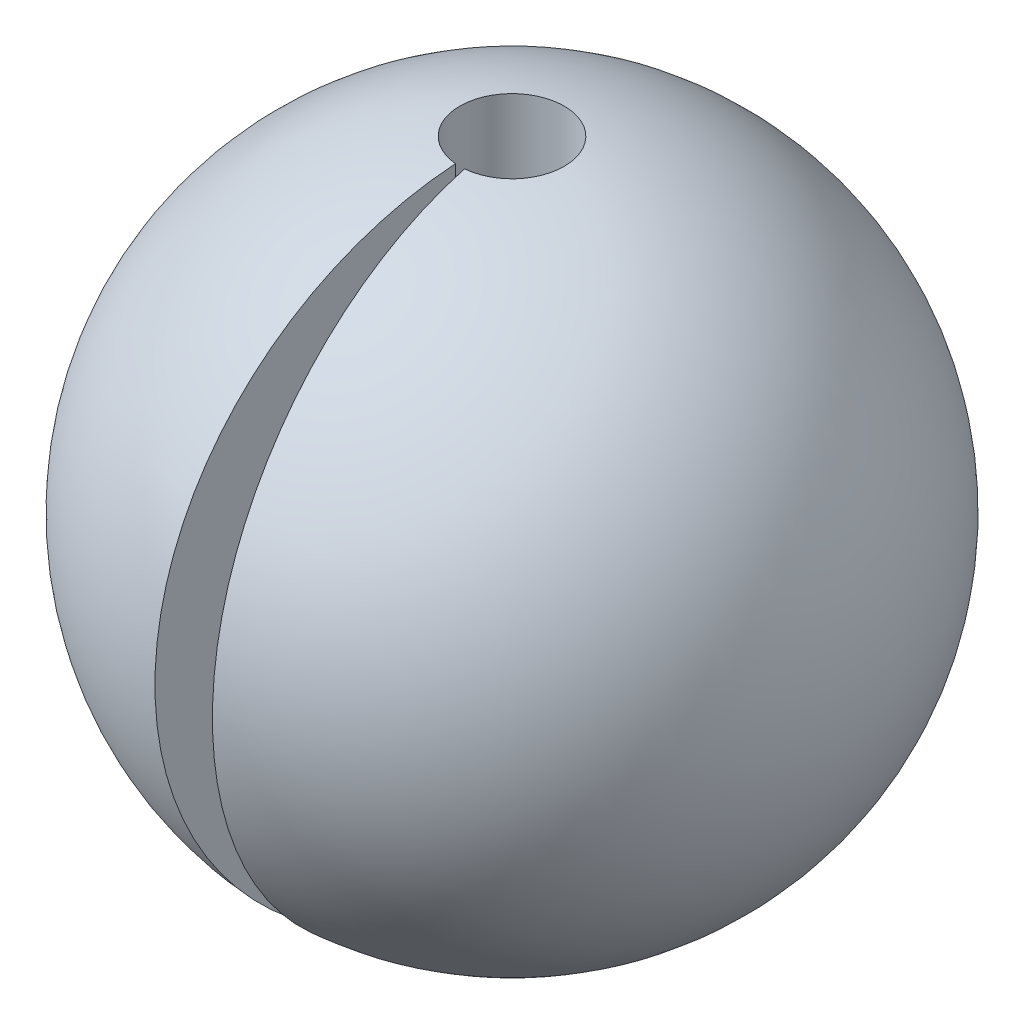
SolidWorks part; units mm, degrees
ref_plane "前视基准面" through (0, 0, 0) normal (0, 0, 1) x (1, 0, 0)
ref_plane "上视基准面" through (0, 0, 0) normal (0, 1, 0) x (1, 0, 0)
ref_plane "右视基准面" through (0, 0, 0) normal (1, 0, 0) x (0, 0, -1)
sketch "草图1" plane through (0, 0, 0) normal (0, 0, 1) x (1, 0, 0)
  line L0 (0, 0) -> (0, 1987.6788) construction
  line L1 (-301, 1876.0061) -> (-301, -1876.0061)
  arc A0 (-301, 1876.0061) -> (-301, -1876.0061) centre (0, 0) ccw
  dimension "D1" = 3800
  dimension "D2" = 301
revolve "旋转2" add sketch "草图1" angle 360 about L0
sketch "草图2" plane through (0, 0, 0) normal (0, 1, 0) x (1, 0, 0)
  line L0 (0, 0) -> (0, -2467.1876) construction
  line L1 (0, 0) -> (-204.5784, -2338.3418)
  line L2 (-204.5784, -2338.3418) -> (204.5784, -2338.3418)
  line L3 (204.5784, -2338.3418) -> (0, 0)
  dimension "D1" = 10
extrude "切除-拉伸1" cut sketch "草图2" against normal through all and the other way through all
